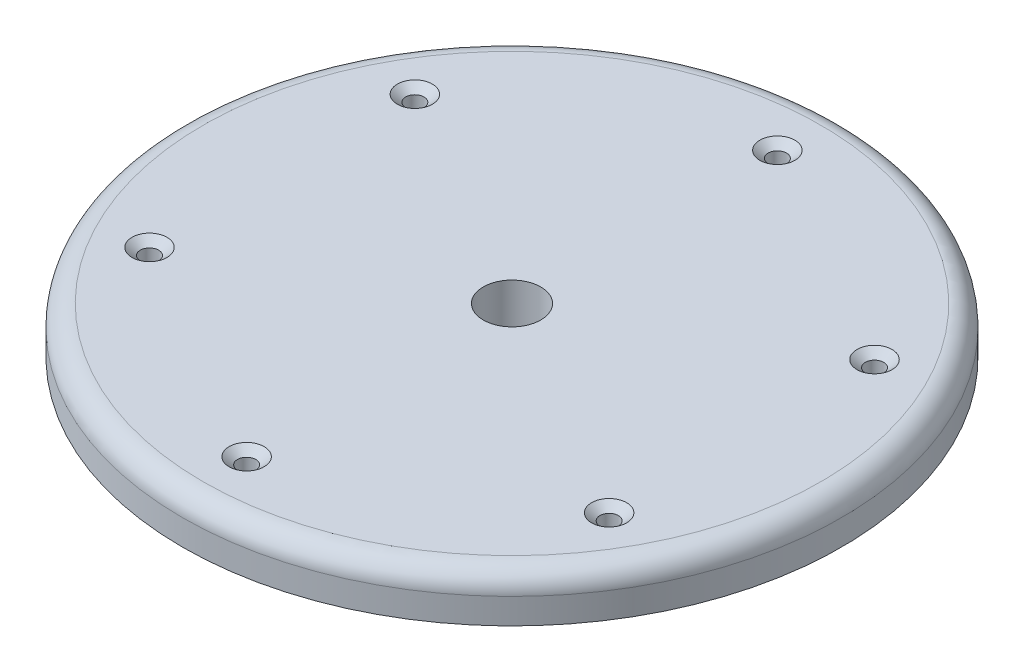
SolidWorks part; units mm, degrees
ref_plane "Front Plane" through (0, 0, 0) normal (0, 0, 1) x (1, 0, 0)
ref_plane "Top Plane" through (0, 0, 0) normal (0, 1, 0) x (1, 0, 0)
ref_plane "Right Plane" through (0, 0, 0) normal (1, 0, 0) x (0, 0, -1)
sketch "Sketch1" plane through (0, 0, 0) normal (0, 1, 0) x (1, 0, 0)
  circle A0 centre (0, 0) radius 121.2294
extrude "Boss-Extrude1" add sketch "Sketch1" along normal blind 17.018
hole_wizard "CSK for 1/4 Flat Head Machine Screw (100)1" positions "Sketch3" profile "Sketch2" countersink size "1/4" standard "ANSI Inch"
sketch "Sketch3" plane through (0, 17.018, 0) normal (0, 1, 0) x (1, 0, 0)
  point P0 (0, 97.6197)
sketch "Sketch2" plane through (0, 17.018, -97.6197) normal (1, 0, 0) x (0, 0, 1)
  line L0 (0, 0) -> (0, 17.018)
  line L1 (0, 17.018) -> (3.3782, 17.018)
  line L2 (3.3782, 17.018) -> (3.3782, 2.5682)
  line L3 (3.3782, 2.5682) -> (6.4389, 0)
  line L5 (6.4389, 0) -> (0, 0)
  line L6 (-3.3782, 2.5682) -> (-6.4389, 0) construction
  line L11 (0, -6.35) -> (0, 107.95) construction
  dimension "Thru Hole Dia." = 6.7564
  dimension "Thru Hole Depth" = 17.018
  dimension "Near C'Sink Dia." = 12.8778
  dimension "Near C'Sink Angle" = 100
mirror "Mirror1" about plane through (0, 0, 0) normal (0, 0, 1) of "CSK for 1/4 Flat Head Machine Screw (100)1"
sketch "Sketch5" plane through (0, 17.018, 0) normal (0, 1, 0) x (1, 0, 0)
  circle A0 centre (0, 0) radius 10.562
extrude "Cut-Extrude1" cut sketch "Sketch5" against normal through all
pattern_circular "CirPattern1" count 6 over 360 about axis through (0, 0, 0) along (0, 1, 0) of "CSK for 1/4 Flat Head Machine Screw (100)1"
fillet "Fillet1" radius 7.62 1 edges at (0, 17.018, 121.2294)
